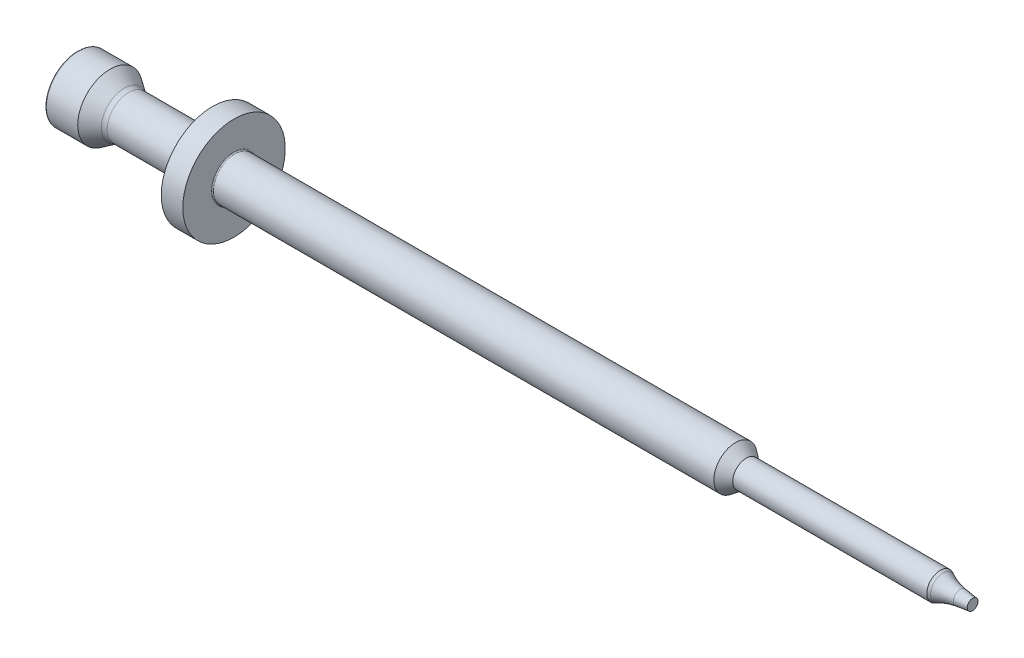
SolidWorks part; units mm, degrees
ref_plane "Front Plane" through (0, 0, 0) normal (0, 0, 1) x (1, 0, 0)
ref_plane "Top Plane" through (0, 0, 0) normal (0, 1, 0) x (1, 0, 0)
ref_plane "Right Plane" through (0, 0, 0) normal (1, 0, 0) x (0, 0, -1)
sketch "Sketch1" plane through (0, 0, 0) normal (0, 0, 1) x (1, 0, 0)
  line L0 (0, 0) -> (3, 0)
  line L1 (3, 0) -> (4.5, 0)
  line L2 (4.5, 0) -> (12.5, 0)
  line L3 (81, 0) -> (83, 0)
  line L4 (14.5, 0) -> (61, 0)
  line L5 (12.5, 0) -> (14.5, 0)
  line L6 (61, 0) -> (62, 0)
  line L7 (81, 0.75) -> (83, 0.5)
  line L8 (80, 0) -> (81, 0)
  line L9 (62, 0) -> (80, 0)
  line L10 (0, 0) -> (0, 3)
  line L11 (3, -3) -> (3, 3) construction
  line L12 (83, 0.5) -> (83, 0)
  line L13 (4.5, -2) -> (4.5, 2) construction
  line L14 (14.5, -4.75) -> (14.5, 4.75) construction
  line L15 (12.5, -4.75) -> (12.5, 4.75) construction
  line L16 (61, -2) -> (61, 2) construction
  line L18 (80, -1.25) -> (80, 1.25) construction
  line L19 (62, -1.25) -> (62, 1.25) construction
  line L20 (0, 3) -> (3, 3)
  line L21 (81, -0.75) -> (81, 0.75) construction
  line L22 (3, 3) -> (4.5, 2)
  line L23 (4.5, 2) -> (12.5, 2)
  line L24 (12.5, 2) -> (12.5, 4.75)
  line L25 (12.5, 4.75) -> (14.5, 4.75)
  line L26 (14.5, 4.75) -> (14.5, 2)
  line L27 (14.5, 2) -> (61, 2)
  line L28 (61, 2) -> (62, 1.25)
  line L29 (62, 1.25) -> (80, 1.25)
  line L30 (80, 1.25) -> (81, 0.75)
  dimension "D2" = 4
  dimension "D3" = 3
  dimension "D4" = 4.5
  dimension "D5" = 9.5
  dimension "D6" = 2
  dimension "D7" = 14.5
  dimension "D8" = 61
  dimension "D9" = 4
  dimension "D10" = 2.5
  dimension "D11" = 1.5
  dimension "D12" = 0.5
  dimension "D13" = 3
  dimension "D14" = 2
  dimension "D15" = 21
  dimension "D16" = 83
  dimension "D17" = 3
revolve "Revolve1" add sketch "Sketch1" angle 360 about L0
fillet "Fillet1" radius 5 1 edges at (81, 0, 0.75)
fillet "Fillet2" radius 0.1 1 edges at (14.5, 0, 2)
fillet "Fillet3" radius 0.75 1 edges at (12.5, 0, 2)
fillet "Fillet4" radius 0.75 1 edges at (4.5, 0, 2)
fillet "Fillet5" radius 0.1 1 edges at (0, 0, 3)
